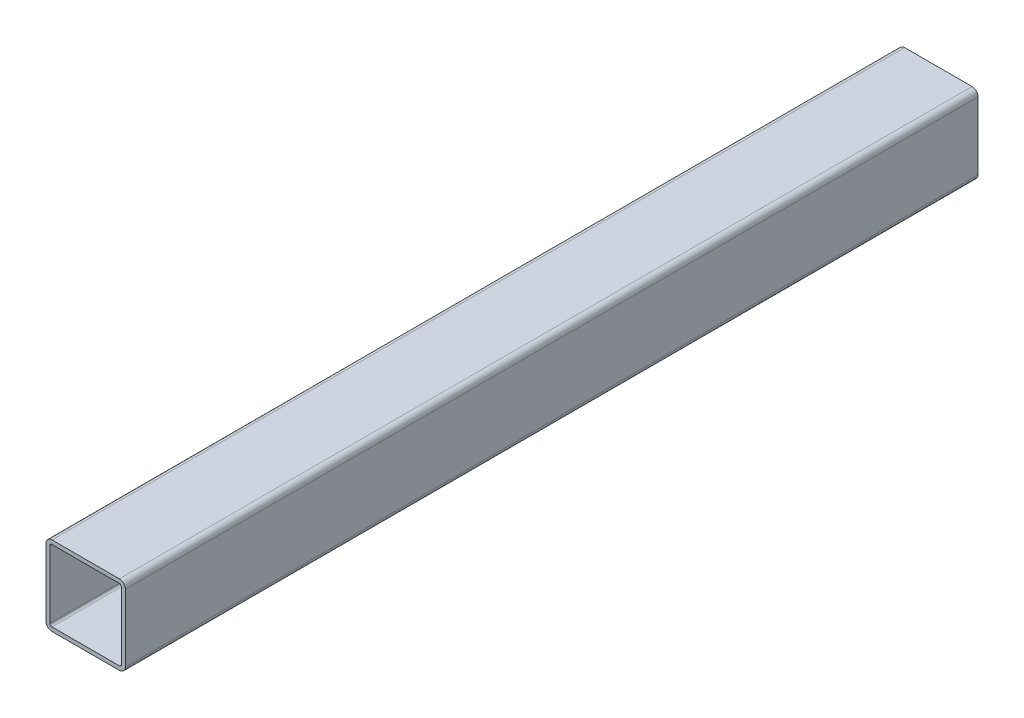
SolidWorks part; units mm, degrees
ref_plane "Plan1" through (0, 0, 0) normal (0, 0, 1) x (1, 0, 0)
ref_plane "Plan2" through (0, 0, 0) normal (0, 1, 0) x (1, 0, 0)
ref_plane "Plan3" through (0, 0, 0) normal (1, 0, 0) x (0, 0, -1)
sketch "Esquisse1" plane through (0, 0, 0) normal (0, 0, 1) x (1, 0, 0)
  line L0 (3, 2) -> (37, 2)
  line L1 (3, 0) -> (37, 0)
  line L2 (0, 3) -> (0, 37)
  line L3 (3, 40) -> (37, 40)
  line L4 (40, 3) -> (40, 37)
  line L5 (38, 3) -> (38, 37)
  line L6 (3, 38) -> (37, 38)
  line L7 (2, 3) -> (2, 37)
  arc A0 (3, 38) -> (2, 37) centre (3, 37) ccw
  arc A1 (38, 37) -> (37, 38) centre (37, 37) ccw
  arc A2 (37, 2) -> (38, 3) centre (37, 3) ccw
  arc A3 (2, 3) -> (3, 2) centre (3, 3) ccw
  arc A4 (3, 40) -> (0, 37) centre (3, 37) ccw
  arc A5 (40, 37) -> (37, 40) centre (37, 37) ccw
  arc A6 (37, 0) -> (40, 3) centre (37, 3) ccw
  arc A7 (0, 3) -> (3, 0) centre (3, 3) ccw
  point P19 (0, 40)
  point P22 (40, 40)
  point P27 (0, 0)
  dimension "D4" = 1
  dimension "D5" = 3
  dimension "D1" = 40
  dimension "D2" = 40
  dimension "D3" = 2
extrude "Extrusion1" add sketch "Esquisse1" along normal blind 430
